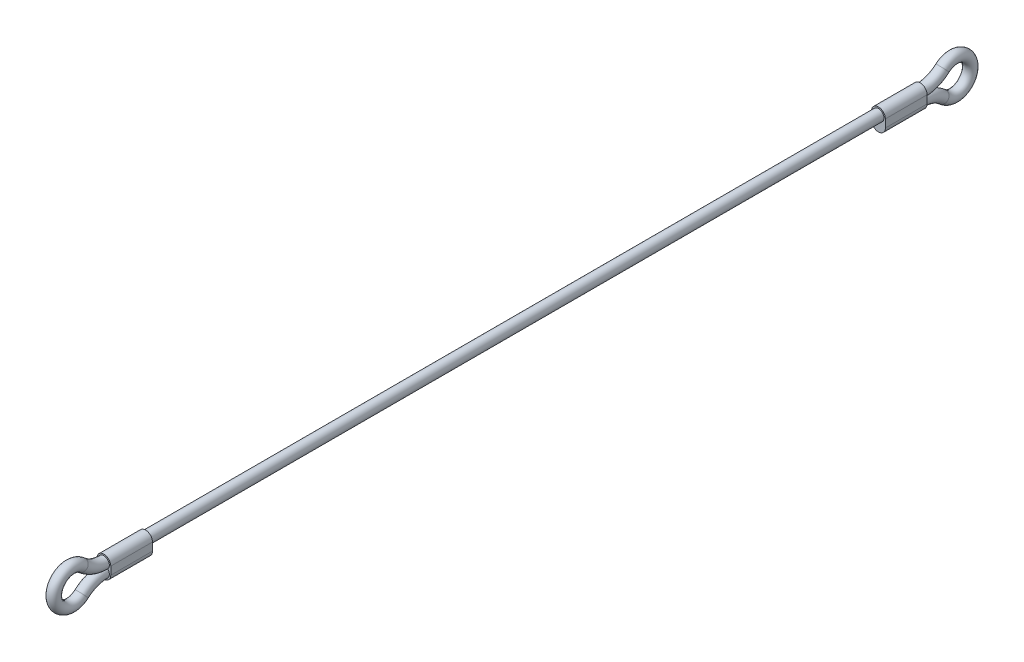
SolidWorks part; units mm, degrees
ref_plane "Front Plane" through (0, 0, 0) normal (0, 0, 1) x (1, 0, 0)
ref_plane "Top Plane" through (0, 0, 0) normal (0, 1, 0) x (1, 0, 0)
ref_plane "Right Plane" through (0, 0, 0) normal (1, 0, 0) x (0, 0, -1)
sketch "Sketch1" plane through (0, 0, 0) normal (1, 0, 0) x (0, 0, -1)
  line L0 (117.4, 0) -> (-117.4, 0)
  line L1 (0, 2.1945) -> (0, -2.1945) construction
  arc A0 (-117.4, 0) -> (-123.8, 2.4446) centre (-117.4, 9.6) cw
  arc A1 (-123.8, 2.4446) -> (-123.8, -4.7108) centre (-127, -1.1331) ccw
  arc A2 (-123.8, -4.7108) -> (-117.4, -2.2663) centre (-117.4, -11.8663) cw
  arc A3 (123.8, -4.7108) -> (117.4, -2.2663) centre (117.4, -11.8663) ccw
  arc A4 (123.8, 2.4446) -> (123.8, -4.7108) centre (127, -1.1331) cw
  arc A5 (117.4, 0) -> (123.8, 2.4446) centre (117.4, 9.6) ccw
  point P18 (0, 0)
  dimension "D1" = 4.8
  dimension "D4" = 9.6
  dimension "D2" = 127
  dimension "D3" = 9.6
sketch "Sketch2" plane through (0, 0, 0) normal (0, 0, 1) x (1, 0, 0)
  circle A0 centre (0, 0) radius 1.59
  dimension "D1" = 3.18
sweep "Sweep1" add profiles "Sketch2" path "Sketch1"
sketch "Sketch3" plane through (0, 0, 117.4) normal (0, 0, -1) x (-1, 0, 0)
  line L0 (0, 0) -> (0, -2.2663) construction
  line L1 (1.995, 0) -> (1.995, -2.2663)
  line L2 (-1.995, 0) -> (-1.995, -2.2663)
  line L3 (-1.59, -2.2663) -> (1.59, -2.2663) construction
  arc A0 (1.995, 0) -> (-1.995, 0) centre (0, 0) ccw
  arc A1 (-1.995, -2.2663) -> (1.995, -2.2663) centre (0, -2.2663) ccw
  point P3 (0, -1.1331)
  dimension "D1" = 3.99
extrude "Boss-Extrude1" add sketch "Sketch3" along normal blind 12
mirror "Mirror1" about plane through (0, 0, 0) normal (0, 0, 1) of "Boss-Extrude1"
